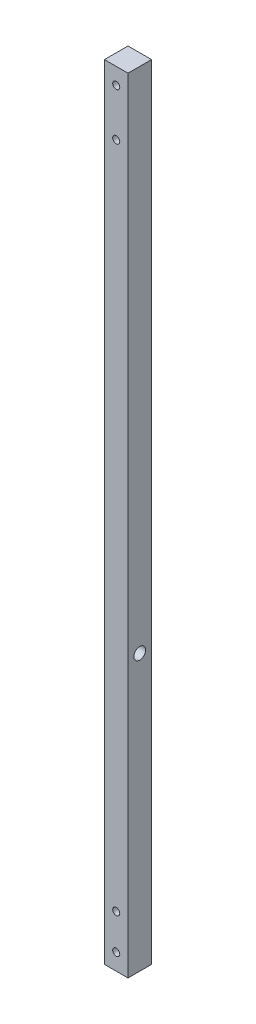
SolidWorks part; units mm, degrees
ref_plane "Front" through (0, 0, 0) normal (0, 0, 1) x (1, 0, 0)
ref_plane "Top" through (0, 0, 0) normal (0, 1, 0) x (1, 0, 0)
ref_plane "Right" through (0, 0, 0) normal (1, 0, 0) x (0, 0, -1)
sketch "Sketch1" plane through (0, 0, 0) normal (0, 1, 0) x (1, 0, 0)
  line L1 (0, 0) -> (10, 0)
  line L2 (0, 0) -> (0, 10)
  line L3 (0, 10) -> (10, 10)
  line L4 (10, 0) -> (10, 10)
extrude "Extrude1" add sketch "Sketch1" along normal blind 333
sketch "Sketch2" plane through (0, 0, 0) normal (0, 0, 1) x (1, 0, 0)
  circle A0 centre (5, 326) radius 1.5
  circle A1 centre (5, 306) radius 1.5
  circle A2 centre (5, 22) radius 1.5
  circle A3 centre (5, 7) radius 1.5
extrude "Cut-Extrude1" cut sketch "Sketch2" against normal through all
sketch "Sketch3" plane through (10, 0, 0) normal (1, 0, 0) x (0, 0, -1)
  circle A0 centre (5, 117) radius 2.5
extrude "Cut-Extrude2" cut sketch "Sketch3" against normal through all
